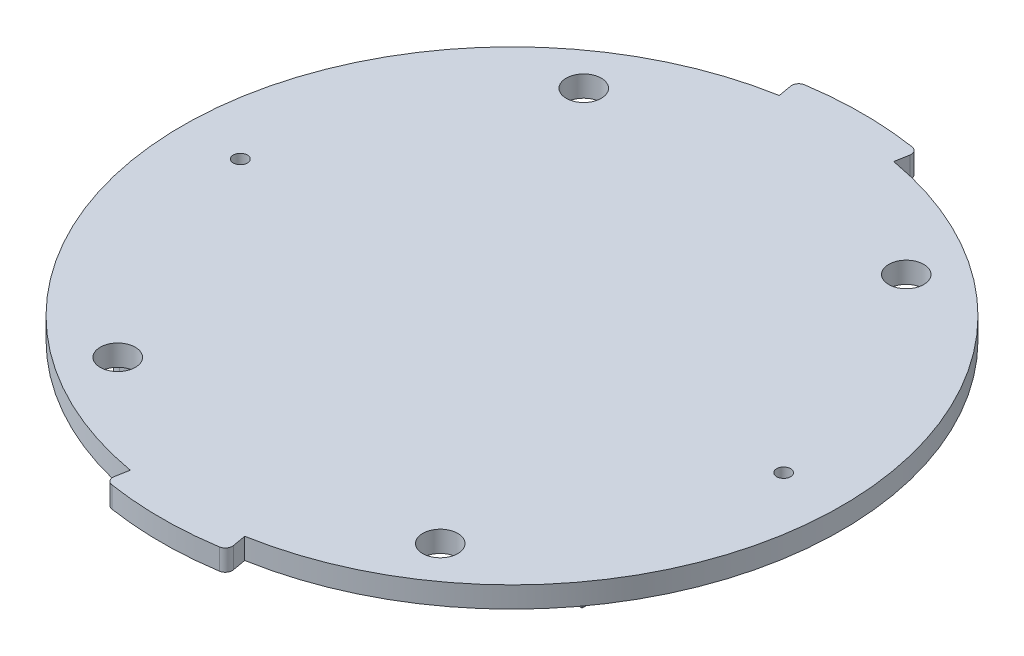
SolidWorks part; units mm, degrees
other "<a_base>-<Supports>"
ref_plane "Front Plane" through (0, 0, 0) normal (0, 0, 1) x (1, 0, 0)
ref_plane "Top Plane" through (0, 0, 0) normal (0, 1, 0) x (1, 0, 0)
ref_plane "Right Plane" through (0, 0, 0) normal (1, 0, 0) x (0, 0, -1)
inserted part "a_base"
sketch "Sketch1" plane through (0, 3, 0) normal (0, 1, 0) x (1, 0, 0)
  line L0 (0, 50) -> (0, 0) construction
  line L1 (0, 0) -> (-50, 0) construction
  circle A0 centre (0, 0) radius 50 construction
  circle A1 centre (0, 0) radius 50
  circle A2 centre (0, 0) radius 47
  dimension "D1" = 3
extrude "Flange Cut" cut sketch "Sketch1" against normal through all
sketch "Sketch2" plane through (0, 3, 0) normal (0, 1, 0) x (1, 0, 0)
  line L0 (0, 47) -> (0, -47) construction
  line L1 (-47, 0) -> (0, 0) construction
  line L2 (0, 0) -> (-8.1615, 46.286) construction
  line L3 (0, 0) -> (8.1615, 46.286) construction
  line L4 (-8.1615, 46.286) -> (-8.6824, 49.2404)
  line L5 (8.1615, 46.286) -> (8.6824, 49.2404)
  line L6 (8.1615, -46.286) -> (8.6824, -49.2404)
  line L7 (-8.1615, -46.286) -> (-8.6824, -49.2404)
  circle A0 centre (0, 0) radius 47 construction
  arc A1 (-8.6824, 49.2404) -> (8.6824, 49.2404) centre (0, 0) cw
  arc A2 (8.1615, 46.286) -> (-8.1615, 46.286) centre (0, 0) ccw
  arc A3 (8.1615, -46.286) -> (-8.1615, -46.286) centre (0, 0) cw
  arc A4 (-8.6824, -49.2404) -> (8.6824, -49.2404) centre (0, 0) ccw
  dimension "D2" = 3
  dimension "D1" = 20
extrude "Flanges" add sketch "Sketch2" against normal up to surface (3 mm away)
sketch "Sketch6" plane through (0, 0, 0) normal (0, -1, 0) x (1, 0, 0)
  line L0 (-47, 0) -> (47, 0) construction
  line L1 (0, 0) -> (0, 50) construction
  line L2 (7.5, -28.5) -> (7.5, -25.5)
  line L3 (-7.5, 28.5) -> (7.5, 28.5)
  line L4 (-7.5, 28.5) -> (-7.5, 25.5)
  line L5 (-7.5, 25.5) -> (7.5, 25.5)
  line L6 (7.5, 28.5) -> (7.5, 25.5)
  line L7 (-7.5, -25.5) -> (7.5, -25.5)
  line L8 (-7.5, -28.5) -> (-7.5, -25.5)
  line L9 (-7.5, -28.5) -> (7.5, -28.5)
  arc A0 (-8.1615, 46.286) -> (-8.1615, -46.286) centre (0, 0) ccw construction
  arc A1 (8.1615, -46.286) -> (8.1615, 46.286) centre (0, 0) ccw construction
  arc A2 (8.6824, 49.2404) -> (-8.6824, 49.2404) centre (0, 0) ccw construction
  dimension "D1" = 15
  dimension "D2" = 3
  dimension "D3" = 25.5
extrude "Base Support" add sketch "Sketch6" along normal blind 3
sketch "Sketch3" plane through (0, 0, 0) normal (0, -1, 0) x (1, 0, 0)
  line L0 (0, 50) -> (0, -50) construction
  line L1 (0, 0) -> (-47, 0) construction
  line L2 (29.5, -22.5) -> (32.5, -22.5)
  line L3 (-29.5, 22.5) -> (-32.5, 22.5)
  line L4 (-29.5, 22.5) -> (-29.5, -22.5)
  line L5 (-29.5, -22.5) -> (-32.5, -22.5)
  line L6 (-32.5, 22.5) -> (-32.5, -22.5)
  line L7 (29.5, 22.5) -> (29.5, -22.5)
  line L8 (29.5, 22.5) -> (32.5, 22.5)
  line L9 (32.5, 22.5) -> (32.5, -22.5)
  arc A0 (8.6824, 49.2404) -> (-8.6824, 49.2404) centre (0, 0) ccw construction
  arc A1 (-8.6824, -49.2404) -> (8.6824, -49.2404) centre (0, 0) ccw construction
  arc A2 (-8.1615, 46.286) -> (-8.1615, -46.286) centre (0, 0) ccw construction
  dimension "D1" = 45
  dimension "D2" = 3
  dimension "D3" = 59
extrude "Side Supports" add sketch "Sketch3" along normal blind 5.6
sketch "Sketch4" plane through (0, 0, 0) normal (0, -1, 0) x (1, 0, 0)
  line L1 (-32.5, 22.5) -> (-20.5, 22.5)
  line L2 (-32.5, 22.5) -> (-32.5, 25.5)
  line L3 (-32.5, 25.5) -> (-20.5, 25.5)
  line L4 (-20.5, 22.5) -> (-20.5, 25.5)
  line L5 (32.5, -22.5) -> (20.5, -22.5)
  line L6 (32.5, -22.5) -> (32.5, -25.5)
  line L7 (32.5, -25.5) -> (20.5, -25.5)
  line L8 (20.5, -22.5) -> (20.5, -25.5)
  dimension "D1" = 12
  dimension "D2" = 3
extrude "Side Support Ends" add sketch "Sketch4" along normal blind 8.6
sketch "Sketch5" plane through (0, 0, 0) normal (0, -1, 0) x (1, 0, 0)
  line L0 (0, 0) -> (-47, 0) construction
  line L1 (0, 0) -> (0, 50) construction
  line L2 (-29.5, -22.5) -> (-29.5, 22.5) construction
  arc A0 (-8.1615, 46.286) -> (-8.1615, -46.286) centre (0, 0) ccw construction
  arc A1 (8.6824, 49.2404) -> (-8.6824, 49.2404) centre (0, 0) ccw construction
  circle A2 centre (-38.75, 0) radius 1
  circle A3 centre (38.75, 0) radius 1
  dimension "D1" = 2
  dimension "D2" = 9.25
extrude "Tendon Routing" cut sketch "Sketch5" against normal through all
fillet "Inner Contouring" radius 2 6 edges at (32.5, -4.3, -25.5) (-32.5, -4.3, 25.5) (29.5, -2.8, 22.5) (-29.5, -2.8, -22.5) (20.5, -4.3, -22.5) (-20.5, -4.3, 22.5)
fillet "Contouring" radius 1 10 edges at (-8.6824, 1.5, 49.2404) (8.6824, 1.5, 49.2404) (8.6824, 1.5, -49.2404) (-8.6824, 1.5, -49.2404) (20.5, -8.6, -25) (21.0858, -8.6, -23.0858) (-20.5, -8.6, 25) (-21.0858, -8.6, 23.0858) (27.5, -8.6, -22.5) (-27.5, -8.6, 22.5)
ref_point "Ref Center"
chamfer "Chamfer1" distance 3 angle 45 6 edges at (-7.5, -1.5, 28.5) (0, 0, 28.5) (7.5, -1.5, 28.5) (0, 0, -28.5) (-7.5, -1.5, -28.5) (7.5, -1.5, -28.5)
equation "\"D1@Sketch1\" = \"width keep@values@params_print.sldprt\""
equation "\"D2@Sketch2\" = \"width keep@values@params_print.sldprt\""
equation "\"D2@Sketch3\" = \"width keep@values@params_print.sldprt\""
equation "\"D2@Sketch4\" = \"width keep@values@params_print.sldprt\""
equation "\"D2@Sketch6\" = \"width keep@values@params_print.sldprt\""
equation "\"D1@Base Support\" = \"width keep@values@params_print.sldprt\""
equation "\"D1@Chamfer1\" = \"width keep@values@params_print.sldprt\""
